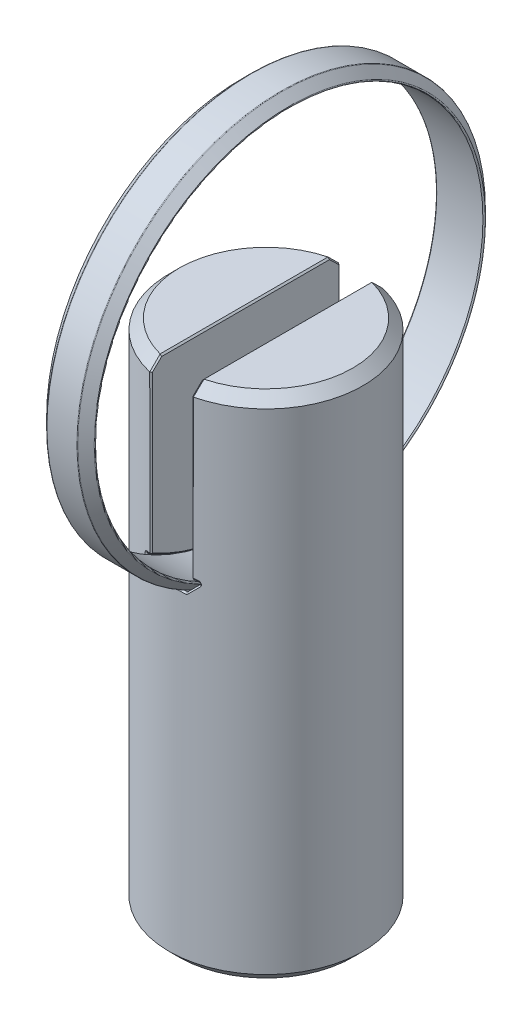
SolidWorks part; units mm, degrees
ref_plane "Спереди" through (0, 0, 0) normal (0, 0, 1) x (1, 0, 0)
ref_plane "Сверху" through (0, 0, 0) normal (0, 1, 0) x (1, 0, 0)
ref_plane "Справа" through (0, 0, 0) normal (1, 0, 0) x (0, 0, -1)
sketch "Эскиз1" plane through (0, 0, 0) normal (0, 1, 0) x (1, 0, 0)
  circle A0 centre (0, 0) radius 9.5
  dimension "D1" = 19
extrude "Бобышка-Вытянуть1" add sketch "Эскиз1" along normal blind 50
sketch "Эскиз2" plane through (0, 0, 0) normal (0, 1, 0) x (1, 0, 0)
  line L1 (-3.5, 3.5) -> (3.5, 3.5)
  line L2 (-3.5, 3.5) -> (-3.5, -3.5)
  line L3 (-3.5, -3.5) -> (3.5, -3.5)
  line L4 (3.5, 3.5) -> (3.5, -3.5)
  line L5 (-3.5, 3.5) -> (3.5, -3.5) construction
  line L6 (-3.5, -3.5) -> (3.5, 3.5) construction
  point P0 (0, 0)
  dimension "D1" = 7
extrude "Вырез-Вытянуть1" cut sketch "Эскиз2" along normal blind 12
chamfer "Фаска1" distance 1 angle 45 10 edges at (0, 0, 3.5) (-3.5, 0, 0) (0, 0, -3.5) (3.5, 0, 0) (0, 12, -3.5) (-3.5, 12, 0) (0, 12, 3.5) (3.5, 12, 0) (0, 0, 9.5) (0, 50, 9.5)
sketch "Эскиз3" plane through (0, 0, 0) normal (0, 0, 1) x (1, 0, 0)
  line L0 (-18.5988, 50) -> (-2.5, 50) construction
  line L1 (0, 0) -> (0, 50) construction
  line L2 (-2.5, 31) -> (-1.5, 30) construction
  line L3 (-2.5, 31) -> (2.5, 31) construction
  line L4 (-1.5, 29.9) -> (1.5, 29.9)
  line L5 (-1.5, 30) -> (1.5, 30) construction
  line L6 (-2.5707, 30.9293) -> (-1.5707, 29.9293)
  line L7 (2.5, 31) -> (1.5, 30) construction
  line L8 (-2.5, 31.1) -> (-2, 31.1)
  line L9 (2.5707, 30.9293) -> (1.5707, 29.9293)
  line L10 (-2, 50) -> (2, 50) construction
  line L11 (-1.5414, 29.9) -> (1.5, 29.9) construction
  line L12 (-2.7414, 31.1) -> (2.5, 31.1) construction
  line L13 (-2.7414, 31.1) -> (-1.5414, 29.9) construction
  line L14 (-2.5, 31.1) -> (-2.5, 50) construction
  line L15 (-2, 50) -> (0, 50)
  line L16 (0, 50) -> (2, 50)
  line L17 (2.5, 50) -> (2.5, 31.1) construction
  line L18 (-2, 31.1) -> (-2, 50)
  line L19 (2, 31.1) -> (2, 50)
  line L20 (2.5, 31.1) -> (2, 31.1)
  line L21 (2.5, 50) -> (18.5988, 50) construction
  arc A0 (1.5707, 29.9293) -> (1.5, 29.9) centre (1.5, 30) cw
  arc A1 (-1.5, 29.9) -> (-1.5707, 29.9293) centre (-1.5, 30) cw
  arc A2 (-2.5707, 30.9293) -> (-2.5, 31.1) centre (-2.5, 31) cw
  arc A3 (2.5, 31.1) -> (2.5707, 30.9293) centre (2.5, 31) cw
  dimension "D8" = 0.1
  dimension "D1" = 50
  dimension "D2" = 20
  dimension "D3" = 5
  dimension "D4" = 0.1
  dimension "D5" = 1
  dimension "D6" = 45
  dimension "D9" = 1
revolve "Вырез-Повернуть1" cut sketch "Эскиз3" angle 360 about L16
chamfer "Фаска2" distance 0.15 angle 45 12 edges at (2, 41.2696, -9.2871) (2, 41.2696, 9.2871) (2, 31.1, 0) (2, 50, 0) (-2, 41.2696, 9.2871) (-2, 41.2696, -9.2871) (-2, 31.1, 0) (-2, 50, 0)
chamfer "Фаска3" distance 0.04 angle 45 18 edges at (2.5978, 33.3653, -9.1379) (2.5849, 33.4041, 9.1416) (1.5291, 32.2258, -9.3761) (1.547, 32.2326, 9.3732) (-1.547, 32.2326, -9.3732) (-1.5291, 32.2258, 9.3761) (-2.5849, 33.4041, -9.1416) (-2.5978, 33.3653, 9.1379)
sketch "Эскиз4" plane through (0, 0, 0) normal (0, 0, 1) x (1, 0, 0)
  line L0 (-2.5, 31) -> (2.5, 31) construction
  line L1 (-2.5, 31) -> (-1.5, 30) construction
  line L2 (-1.5, 30) -> (1.5, 30) construction
  line L3 (2.5, 31) -> (1.5, 30) construction
  line L4 (-2.2586, 31) -> (2.2586, 31)
  line L5 (-2.3293, 30.8293) -> (-1.5293, 30.0293)
  line L6 (-1.4586, 30) -> (1.4586, 30)
  line L7 (2.3293, 30.8293) -> (1.5293, 30.0293)
  arc A0 (-1.5293, 30.0293) -> (-1.4586, 30) centre (-1.4586, 30.1) ccw
  arc A1 (1.4586, 30) -> (1.5293, 30.0293) centre (1.4586, 30.1) ccw
  arc A2 (2.2586, 31) -> (2.3293, 30.8293) centre (2.2586, 30.9) cw
  arc A3 (-2.2586, 31) -> (-2.3293, 30.8293) centre (-2.2586, 30.9) ccw
  dimension "D1" = 0.1
revolve "Повернуть1" add sketch "Эскиз4" angle 360 about L16
